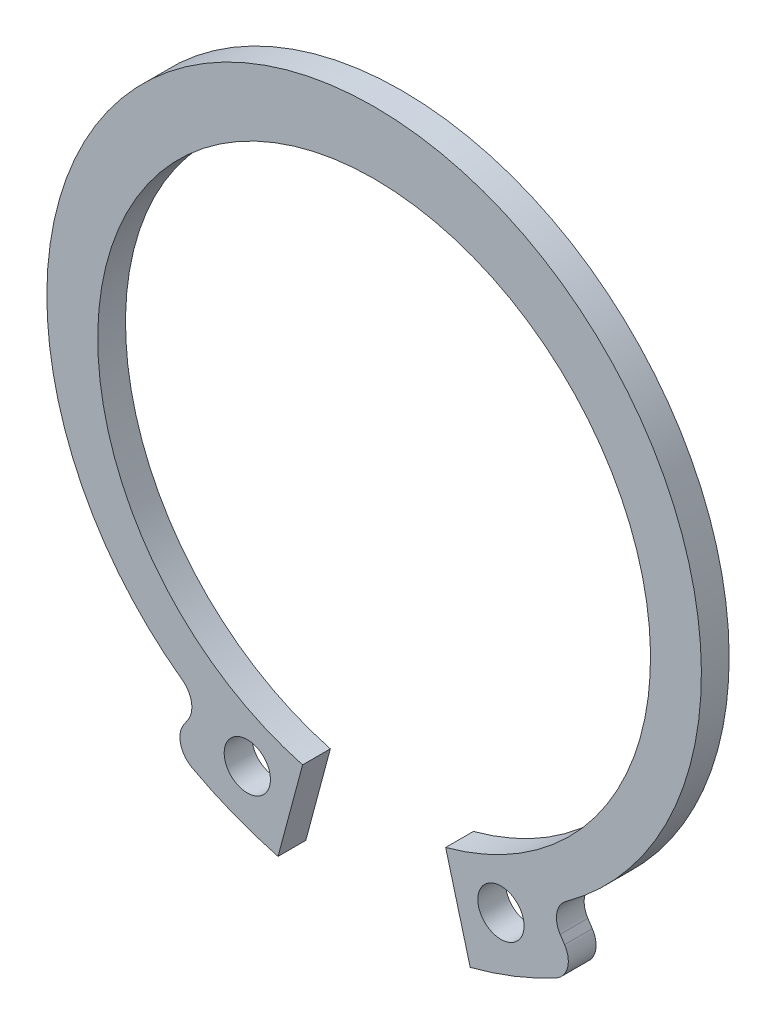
SolidWorks part; units mm, degrees
ref_plane "Plan1" through (0, 0, 0) normal (0, 0, 1) x (1, 0, 0)
ref_plane "Plan2" through (0, 0, 0) normal (0, 1, 0) x (1, 0, 0)
ref_plane "Plan3" through (0, 0, 0) normal (1, 0, 0) x (0, 0, -1)
sketch "Esquisse1" plane through (0, 0, 0) normal (0, 0, 1) x (1, 0, 0)
  line L0 (0, 0) -> (4.154, -15.5031) construction
  line L1 (0, 0) -> (0, -67.082) construction
  line L2 (8.0434, -12.3208) -> (8.234, -12.6127)
  line L3 (3.0929, -11.5428) -> (4.154, -15.5031)
  line L4 (-3.0929, -11.5428) -> (-4.154, -15.5031)
  line L5 (-8.0434, -12.3208) -> (-8.234, -12.6127)
  line L6 (3.0929, -11.5428) -> (7.8728, -14.0387) construction
  line L7 (0, 0) -> (0, 11.95) construction
  line L8 (0, 11.95) -> (0, 14.65) construction
  arc A0 (3.0929, -11.5428) -> (-3.0929, -11.5428) centre (0, 0) ccw
  arc A1 (4.154, -15.5031) -> (7.8728, -14.0387) centre (0, 0.5) ccw
  arc A2 (8.2946, -10.964) -> (-8.2946, -10.964) centre (0, 0.5) ccw
  arc A3 (-7.8728, -14.0387) -> (-4.154, -15.5031) centre (0, 0.5) ccw
  arc A4 (-8.2946, -10.964) -> (-8.0434, -12.3208) centre (-8.8807, -11.7742) cw
  arc A5 (8.2946, -10.964) -> (8.0434, -12.3208) centre (8.8807, -11.7742) ccw
  circle A6 centre (5.4828, -12.7908) radius 1
  circle A7 centre (-5.4828, -12.7908) radius 1
  arc A8 (-7.8728, -14.0387) -> (-8.234, -12.6127) centre (-7.3966, -13.1594) cw
  arc A9 (7.8728, -14.0387) -> (8.234, -12.6127) centre (7.3966, -13.1594) ccw
  point P22 (-8.808, -13.492)
  dimension "D1" = 23.9
  dimension "D2" = 4.1
  dimension "D3" = 2.7
  dimension "R" = 1
  dimension "D8" = 2
  dimension "D4" = 0.5
  dimension "D5" = 5
  dimension "a" = 15
extrude "Base-Extrusion" add sketch "Esquisse1" along normal blind 1.2
equation "\"R@Esquisse1\" = \"D8@Esquisse1\"/2"
equation "\"D4@Esquisse1\"=\"R@Esquisse1\"/2"
equation "\"D5@Esquisse1\"=\"D8@Esquisse1\"*2.5"
